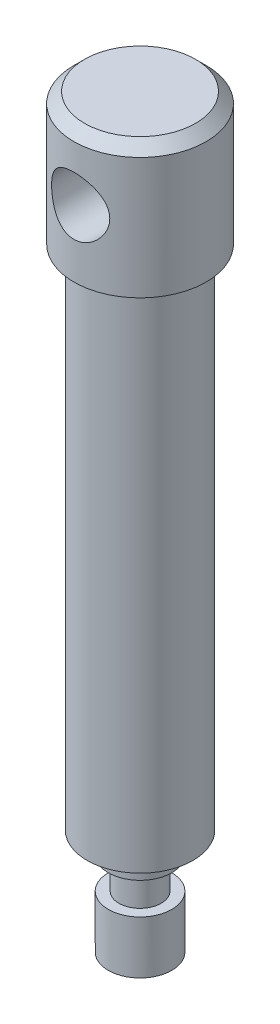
SolidWorks part; units mm, degrees
ref_plane "Front" through (0, 0, 0) normal (0, 0, 1) x (1, 0, 0)
ref_plane "Top" through (0, 0, 0) normal (0, 1, 0) x (1, 0, 0)
ref_plane "Right" through (0, 0, 0) normal (1, 0, 0) x (0, 0, -1)
sketch "Sketch1" plane through (0, 0, 0) normal (0, 0, 1) x (1, 0, 0)
  line L0 (0, 0) -> (0, 167.1475) construction
  line L1 (0, 0) -> (6, 3.4641)
  line L2 (6, 3.4641) -> (6, 13.4641)
  line L3 (6, 13.4641) -> (4, 13.4641)
  line L4 (4, 13.4641) -> (4, 19.4641)
  line L5 (4, 19.4641) -> (6, 19.4641)
  line L6 (6, 19.4641) -> (6, 23.4641)
  line L7 (6, 23.4641) -> (10, 23.4641)
  line L8 (10, 23.4641) -> (10, 119.4641)
  line L9 (10, 119.4641) -> (12.5, 119.4641)
  line L10 (12.5, 119.4641) -> (12.5, 144.4641)
  line L11 (12.5, 144.4641) -> (0, 144.4641)
  line L12 (0, 144.4641) -> (0, 0)
  dimension "D1" = 12
  dimension "D2" = 10
  dimension "D3" = 4
  dimension "D4" = 96
  dimension "D5" = 25
  dimension "D6" = 60
  dimension "D7" = 25
  dimension "D8" = 20
  dimension "D9" = 6
  dimension "D10" = 4
revolve "Revolve1" add sketch "Sketch1" angle 360 about L0
sketch "Sketch2" plane through (0, 0, 0) normal (0, 0, 1) x (1, 0, 0)
  line L0 (12.5, 144.4641) -> (-12.5, 144.4641) construction
  circle A0 centre (0, 131.9641) radius 5.5
  dimension "D1" = 11
  dimension "D2" = 12.5
extrude "Cut-Extrude1" cut sketch "Sketch2" against normal through all and the other way through all
chamfer "Chamfer1" distance 2 angle 45 1 edges at (0, 144.4641, -12.5)
